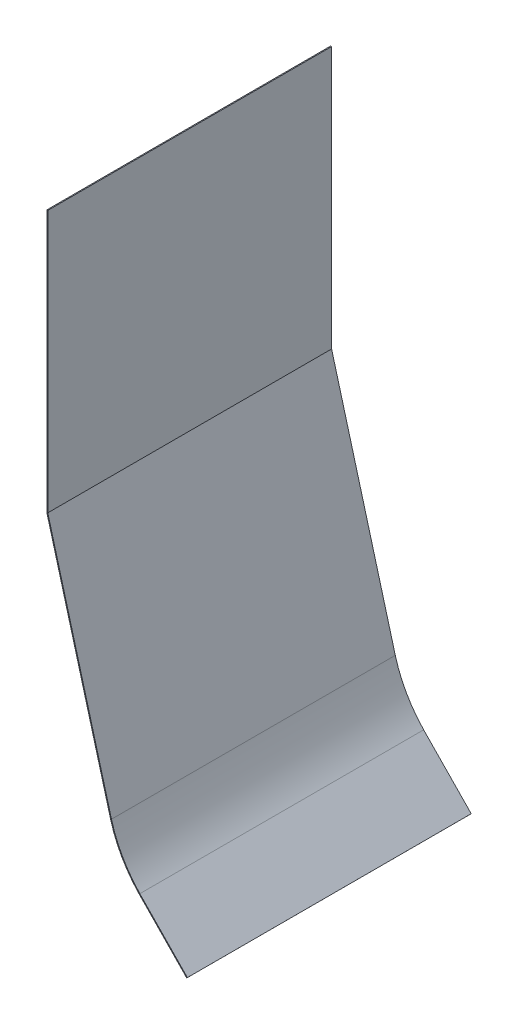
SolidWorks part; units mm, degrees
ref_plane "Front Plane" through (0, 0, 0) normal (0, 0, 1) x (1, 0, 0)
ref_plane "Top Plane" through (0, 0, 0) normal (0, 1, 0) x (1, 0, 0)
ref_plane "Right Plane" through (0, 0, 0) normal (1, 0, 0) x (0, 0, -1)
sketch "Sketch2" plane through (0, 0, 0) normal (0, 0, 1) x (1, 0, 0)
  line L0 (-1160.5685, 2237.3861) -> (-1160.5685, 3420.3861) construction
  line L1 (-574.2012, 840.1751) -> (-773.9468, 1045.5334)
  line L2 (0, 0) -> (0, 837.3174) construction
  line L3 (0, 837.3174) -> (-577, 837.3174) construction
  line L4 (-1160.5685, 2237.3861) -> (-893.0831, 1256.8497)
  line L5 (-1160.5685, 3337.3861) -> (-1160.5685, 2237.3861)
  line L6 (-896.9421, 1255.797) -> (-893.0831, 1256.8497) construction
  line L7 (-1164.5685, 3337.3861) -> (-1164.7147, 2237.3861)
  line L8 (-1164.7147, 2237.3861) -> (-896.9421, 1255.797)
  line L9 (-577, 837.3174) -> (-776.8296, 1042.7604)
  line L10 (-577, 837.3174) -> (-574.2012, 840.1751)
  line L11 (-1160.5685, 3337.3861) -> (-1164.5685, 3337.3861)
  line L12 (-773.9468, 1045.5334) -> (-776.8296, 1042.7604) construction
  arc A0 (-893.0831, 1256.8497) -> (-773.9468, 1045.5334) centre (-414.5685, 1387.3861) ccw
  arc A1 (-896.9421, 1255.797) -> (-776.8296, 1042.7604) centre (-414.5685, 1387.3861) ccw
  dimension "D2" = 1100
  dimension "D4" = 4
  dimension "D7" = 4
  dimension "D5" = 4
  dimension "D6" = 500
  dimension "D3" = 577
  dimension "D8" = 4.0001
  dimension "D9" = 28.629
  dimension "D10" = 4
extrude "Boss-Extrude1" add sketch "Sketch2" along normal mid plane 1192 contours L4 A0 L1 L10 L9 A1 L8 L7 L11 L5
